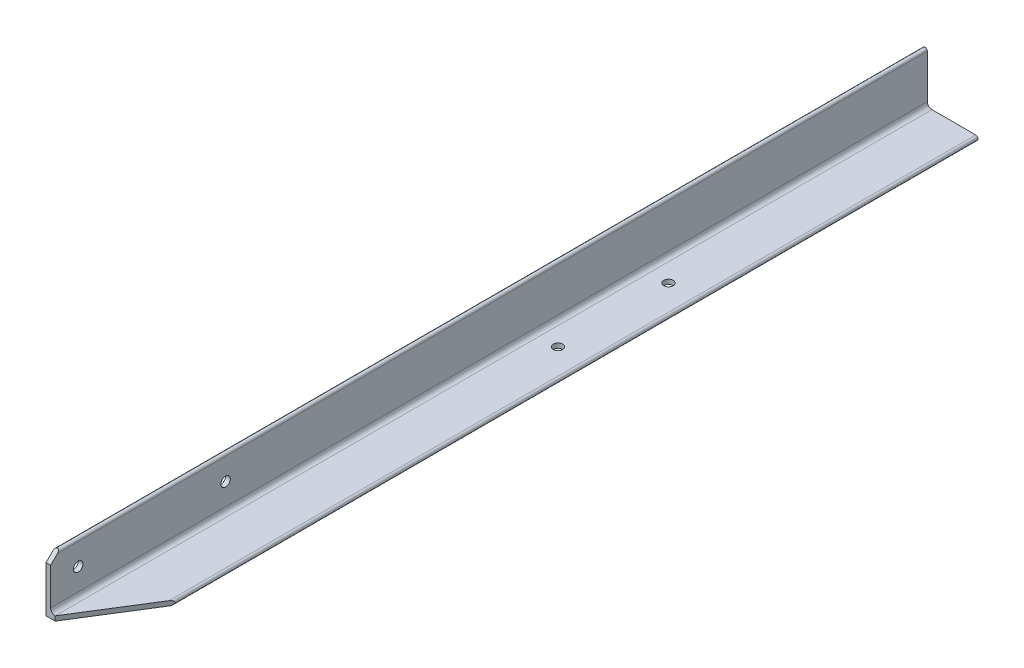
SolidWorks part; units mm, degrees
ref_plane "Front" through (0, 0, 0) normal (0, 0, 1) x (1, 0, 0)
ref_plane "Top" through (0, 0, 0) normal (0, 1, 0) x (1, 0, 0)
ref_plane "Right" through (0, 0, 0) normal (1, 0, 0) x (0, 0, -1)
sketch "Sketch1" plane through (0, 0, 0) normal (0, 0, 1) x (1, 0, 0)
  line L0 (0, 0) -> (0, 36.5125)
  line L1 (0, 0) -> (36.5125, 0)
  line L2 (6.35, 3.175) -> (36.5125, 3.175)
  line L3 (3.175, 6.35) -> (3.175, 36.5125)
  line L4 (3.175, 3.175) -> (3.175, 38.1) construction
  line L5 (3.175, 3.175) -> (38.1, 3.175) construction
  line L6 (0, 38.1) -> (3.175, 38.1) construction
  line L7 (38.1, 3.175) -> (38.1, 0) construction
  line L9 (0, 0) -> (38.1, 0) construction
  line L10 (0, 0) -> (0, 38.1) construction
  arc A0 (3.175, 6.35) -> (6.35, 3.175) centre (6.35, 6.35) ccw
  arc A1 (3.175, 36.5125) -> (0, 36.5125) centre (1.5875, 36.5125) ccw
  arc A2 (36.5125, 0) -> (36.5125, 3.175) centre (36.5125, 1.5875) ccw
  dimension "D4" = 3.175
  dimension "D1" = 38.1
  dimension "D2" = 38.1
  dimension "D3" = 3.175
extrude "Boss-Extrude1" add sketch "Sketch1" along normal mid plane 604.4921
sketch "Sketch2" plane through (3.175, 0, 0) normal (1, 0, 0) x (0, 0, -1)
  line L0 (-302.246, 31.75) -> (-295.896, 38.1)
  line L1 (-302.246, 6.35) -> (-302.246, 36.5125) construction
  line L2 (302.246, 38.1) -> (-302.246, 38.1) construction
  line L3 (-295.896, 38.1) -> (-302.246, 38.1)
  line L4 (-302.246, 38.1) -> (-302.246, 36.5125) construction
  line L5 (-302.246, 38.1) -> (-302.246, 31.75)
  line L6 (302.246, 38.1) -> (-302.246, 38.1) construction
  circle A0 centre (-283.196, 21.4313) radius 3.2385
  circle A1 centre (-181.596, 21.4313) radius 3.2385
  point P11 (-302.246, 21.4313)
  point P16 (0, 0)
  dimension "D4" = 6.477
  dimension "D6" = 101.6
  dimension "D1" = 6.35
  dimension "D2" = 6.35
  dimension "D3" = 19.05
  dimension "D7" = 16.6687
  dimension "D5" = 2
extrude "Cut-Extrude1" cut sketch "Sketch2" against normal through all
sketch "Sketch3" plane through (0, 0, 0) normal (0, -1, 0) x (-1, 0, 0)
  line L0 (-38.1, -302.246) -> (-38.1, -251.446)
  line L1 (-38.1, 302.246) -> (-38.1, -302.246) construction
  line L2 (-38.1, -251.446) -> (-6.35, -302.246)
  line L3 (0, -302.246) -> (-36.5125, -302.246) construction
  line L4 (-6.35, -302.246) -> (-38.1, -302.246)
  dimension "D1" = 31.75
  dimension "D2" = 50.8
extrude "Cut-Extrude2" cut sketch "Sketch3" against normal through all
sketch "Sketch4" plane through (0, 0, 0) normal (0, -1, 0) x (1, 0, 0)
  line L0 (0, 302.246) -> (0, -302.246) construction
  line L1 (0, 302.246) -> (6.35, 302.246) construction
  circle A0 centre (19.05, -31.6885) radius 3.2385
  circle A1 centre (19.05, -107.8885) radius 3.2385
  point P6 (0, 0)
  point P7 (0, 0)
  dimension "D1" = 6.477
  dimension "D2" = 76.2
  dimension "D3" = 19.05
  dimension "D4" = 333.9346
extrude "Cut-Extrude3" cut sketch "Sketch4" against normal through all both and the other way through all
